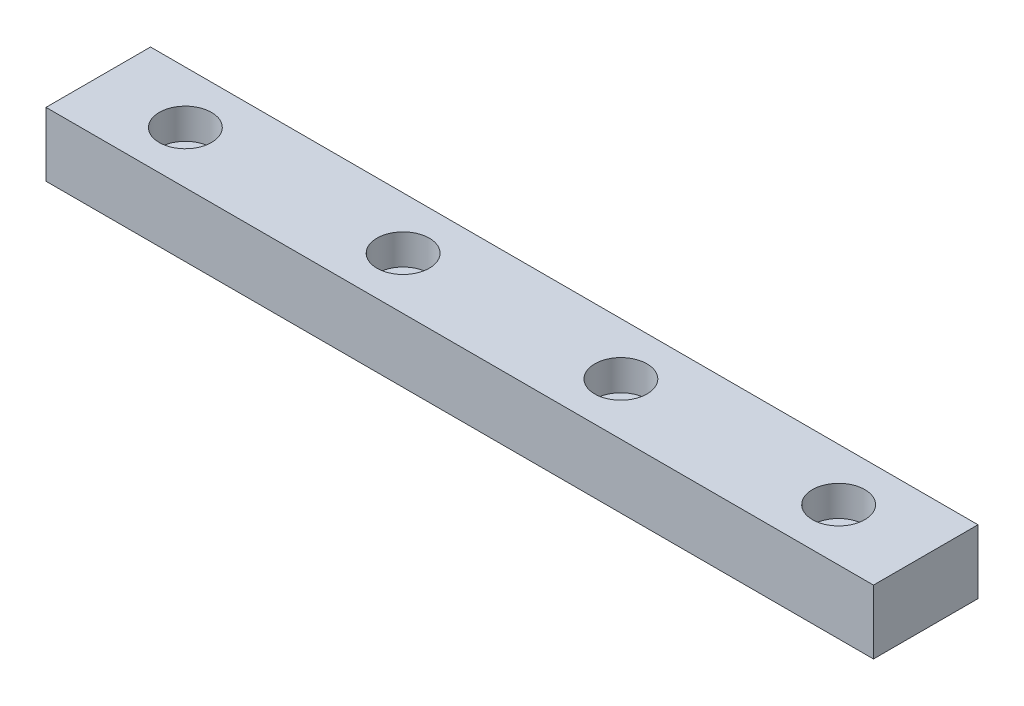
SolidWorks part; units mm, degrees
ref_plane "前视基准面" through (0, 0, 0) normal (0, 0, 1) x (1, 0, 0)
ref_plane "上视基准面" through (0, 0, 0) normal (0, 1, 0) x (1, 0, 0)
ref_plane "右视基准面" through (0, 0, 0) normal (1, 0, 0) x (0, 0, -1)
sketch "草图1" plane through (0, 0, 0) normal (0, 0, 1) x (1, 0, 0)
  line L0 (95, 0) -> (95, 7.35)
  line L1 (0, 0) -> (0, 7.35)
  line L2 (0, 7.35) -> (95, 7.35)
  line L3 (0, 0) -> (95, 0)
extrude "凸台-拉伸1" add sketch "草图1" along normal blind 12
sketch "草图2" plane through (0, 7.35, 0) normal (0, 1, 0) x (1, 0, 0)
  circle A0 centre (60, -6) radius 1.75
  circle A1 centre (35, -6) radius 1.75
  circle A2 centre (10, -6) radius 1.75
  circle A3 centre (85, -6) radius 1.75
extrude "切除-拉伸1" cut sketch "草图2" against normal blind 12
sketch "草图3" plane through (0, 7.35, 0) normal (0, 1, 0) x (1, 0, 0)
  circle A0 centre (60, -6) radius 3
  circle A1 centre (35, -6) radius 3
  circle A2 centre (10, -6) radius 3
  circle A3 centre (85, -6) radius 3
extrude "切除-拉伸2" cut sketch "草图3" against normal blind 3.5
